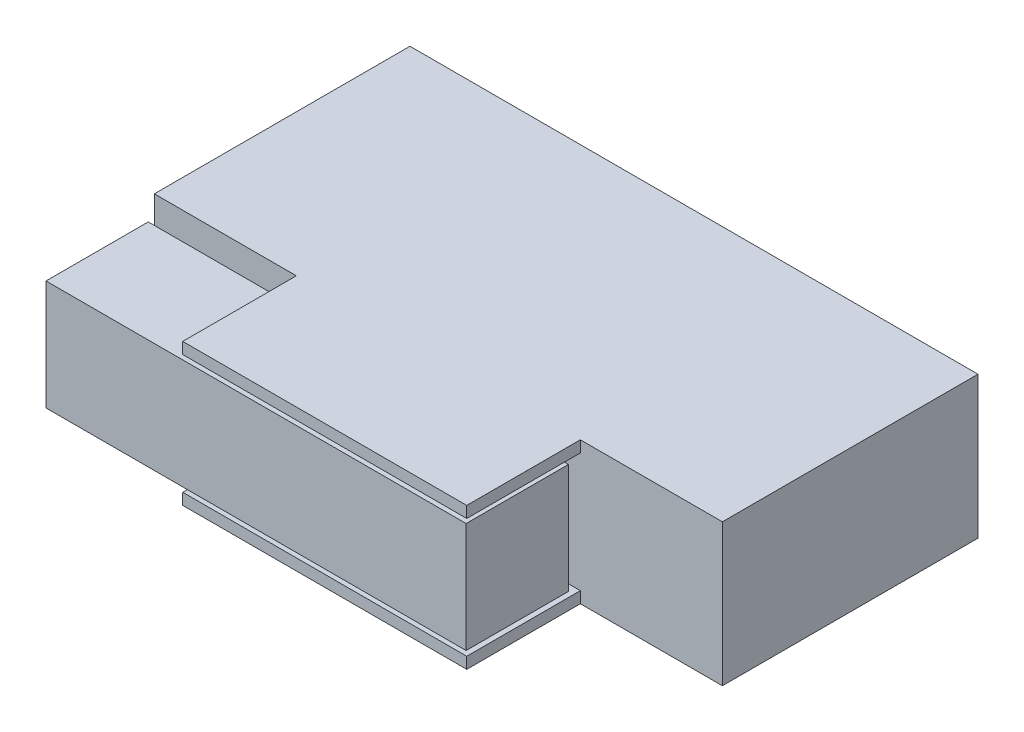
SolidWorks part; units mm, degrees
ref_plane "Plan de face" through (0, 0, 0) normal (0, 0, 1) x (1, 0, 0)
ref_plane "Plan de dessus" through (0, 0, 0) normal (0, 1, 0) x (1, 0, 0)
ref_plane "Plan de droite" through (0, 0, 0) normal (1, 0, 0) x (0, 0, -1)
sketch "Esquisse1" plane through (0, 0, 0) normal (0, 0, 1) x (1, 0, 0)
  line L1 (0, 0) -> (10, 0)
  line L2 (0, 0) -> (0, 2.5)
  line L3 (0, 2.5) -> (10, 2.5)
  line L4 (10, 0) -> (10, 2.5)
  dimension "D1" = 10
  dimension "D2" = 2.5
extrude "Extrusion1" add sketch "Esquisse1" along normal blind 6.5
sketch "Esquisse2" plane through (0, 0, 6.5) normal (0, 0, 1) x (1, 0, 0)
  line L0 (10, 2.5) -> (0, 2.5) construction
  line L1 (2.5, 2.3) -> (7.5, 2.3)
  line L3 (2.5, 0.2) -> (7.5, 0.2)
  line L4 (7.5, 0.2) -> (7.5, 0)
  line L5 (0, 0) -> (10, 0) construction
  line L7 (2.5, 2.3) -> (2.5, 2.5)
  line L8 (2.5, 2.5) -> (0, 2.5)
  line L9 (0, 2.5) -> (0, 0)
  line L10 (0, 0) -> (2.5, 0)
  line L11 (2.5, 0) -> (2.5, 0.2)
  line L12 (7.5, 2.3) -> (7.5, 2.5)
  line L13 (7.5, 2.5) -> (10, 2.5)
  line L14 (10, 2.5) -> (10, 0)
  line L15 (10, 0) -> (10, 2.5) construction
  line L16 (10, 0) -> (7.5, 0)
  dimension "D1" = 0.2
  dimension "D2" = 0.2
  dimension "D4" = 2.5
  dimension "D5" = 2.5
  dimension "D6" = 2.5
extrude "Extrusion2" cut sketch "Esquisse2" against normal blind 2
sketch "Esquisse3" plane through (0, 0, 6.5) normal (0, 0, 1) x (1, 0, 0)
  line L1 (7.489, 2.2182) -> (0.0932, 2.2182)
  line L2 (7.489, 2.2182) -> (7.489, 0.2818)
  line L3 (7.489, 0.2818) -> (0.0932, 0.2818)
  line L4 (0.0932, 2.2182) -> (0.0932, 0.2818)
extrude "Extrusion3" add sketch "Esquisse3" against normal blind 1.8
